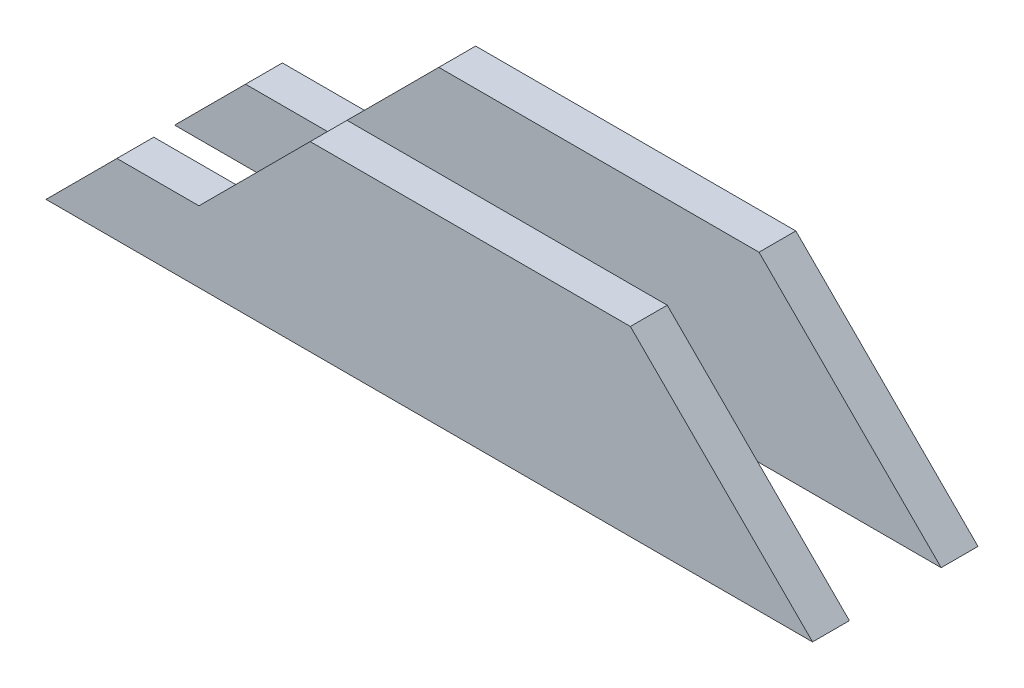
SolidWorks part; units mm, degrees
ref_plane "Front" through (0, 0, 0) normal (0, 0, 1) x (1, 0, 0)
ref_plane "Top" through (0, 0, 0) normal (0, 1, 0) x (1, 0, 0)
ref_plane "Right" through (0, 0, 0) normal (1, 0, 0) x (0, 0, -1)
sketch "Sketch1" plane through (0, 0, 0) normal (0, 1, 0) x (1, 0, 0)
  line L0 (24.765, 0) -> (0, 0) construction
  line L1 (-115.2652, 15.113) -> (24.765, 15.113)
  line L2 (-115.2652, 15.113) -> (-115.2652, -15.113)
  line L3 (-115.2652, -15.113) -> (24.765, -15.113)
  line L4 (24.765, 15.113) -> (24.765, -15.113)
  dimension "D1" = 30.226
  dimension "D2" = 140.0302
  dimension "D3" = 24.765
extrude "Extrude1" add sketch "Sketch1" along normal blind 12.954
sketch "Sketch2" plane through (0, 0, 0) normal (0, 0, 1) x (1, 0, 0)
  line L0 (11.811, 12.954) -> (-8.509, 33.274)
  line L1 (-8.509, 33.274) -> (-67.0052, 33.274)
  line L2 (-67.0052, 33.274) -> (-87.3252, 12.954)
  line L3 (-87.3252, 12.954) -> (11.811, 12.954)
  line L4 (-115.2652, 12.954) -> (24.765, 12.954) construction
  line L5 (11.811, 12.954) -> (24.765, 0) construction
  line L6 (-115.2652, 0) -> (24.765, 0) construction
  dimension "D1" = 45
  dimension "D2" = 27.94
  dimension "D3" = 33.274
  dimension "D4" = 45
extrude "Extrude2" add sketch "Sketch2" along normal up to surface and the other way up to surface
sketch "Sketch4" plane through (0, 0, 0) normal (1, 0, 0) x (0, 0, -1)
  line L0 (0, 0) -> (0, -8.4471) construction
  line L1 (8.382, -8.4471) -> (-8.382, -8.4471)
  line L2 (8.382, -8.4471) -> (8.382, 33.274)
  line L3 (8.382, 33.274) -> (-8.382, 33.274)
  line L4 (-8.382, -8.4471) -> (-8.382, 33.274)
  line L8 (-15.113, 33.274) -> (15.113, 33.274) construction
  dimension "D1" = 16.764
extrude "Extrude4" cut sketch "Sketch4" against normal through all and the other way through all
fillet "Fillet2" [suppressed] radius 2.3812
fillet "Fillet6" [suppressed] radius 2.3812
sketch "Sketch7" plane through (0, 0, 0) normal (0, 0, 1) x (1, 0, 0)
  line L0 (11.811, 12.954) -> (24.765, 0)
  line L1 (24.765, 0) -> (24.765, 12.954)
  line L2 (24.765, 12.954) -> (11.811, 12.954)
  line L3 (-102.3112, 12.954) -> (-115.2652, 12.954)
  line L4 (-115.2652, 12.954) -> (-115.2652, 0)
  line L5 (-115.2652, 0) -> (-102.3112, 12.954)
  line L6 (-115.2652, 0) -> (24.765, 0) construction
  line L7 (-115.2652, 12.954) -> (-115.2652, 0) construction
  line L8 (-115.2652, 12.954) -> (-87.3252, 12.954) construction
  line L9 (24.765, 12.954) -> (24.765, 0) construction
  line L10 (11.811, 12.954) -> (24.765, 12.954) construction
  dimension "D1" = 45
  dimension "D2" = 45
extrude "Extrude5" cut sketch "Sketch7" against normal through all and the other way through all
hole_wizard "#6-32 Tapped Hole2" positions "Sketch6" profile "Sketch5" tap size "#6-32" standard "Ansi Inch"
sketch "Sketch6" plane through (-15.8415, 4.1661, -15.113) normal (0, 0, 1) x (-1, 0, 0)
  line L2 (-40.6065, 4.1661) -> (99.4237, 4.1661) construction
  point P0 (80.3737, -2.1839)
  point P1 (-22.8138, 0.9911)
  dimension "D1" = 19.05
  dimension "D2" = 103.1875
  dimension "D3" = 6.35
  dimension "D4" = 3.175
sketch "Sketch5" plane through (-96.2152, 6.35, -15.113) normal (1, 0, 0) x (0, 1, 0)
  line L0 (0, 0) -> (0, 10.2107)
  line L1 (0, 10.2107) -> (1.3525, 9.398)
  line L2 (1.3525, 9.398) -> (1.3525, 0)
  line L5 (1.3525, 0) -> (0, 0)
  line L10 (0, 10.2107) -> (-1.3525, 9.398) construction
  line L11 (0, -6.35) -> (0, 107.95) construction
  dimension "Tap Drill Dia." = 2.7051
  dimension "Tap Drill Depth" = 9.398
  dimension "Drill Angle" = 118
hole_wizard "CSK for #6 Flat Head Machine Screw1" positions "Sketch9" profile "Sketch8" countersink size "#6" standard "Ansi Inch"
sketch "Sketch9" plane through (-36.8166, 6.8378, 15.113) normal (0, 0, -1) x (-1, 0, 0)
  line L0 (78.4486, -6.8378) -> (-61.5816, -6.8378) construction
  point P3 (59.3986, -0.4878)
  point P5 (-43.7889, -3.6628)
  dimension "D1" = 19.05
  dimension "D2" = 6.35
  dimension "D3" = 103.1875
  dimension "D4" = 3.175
sketch "Sketch8" plane through (-96.2152, 6.35, 15.113) normal (1, 0, 0) x (0, -1, 0)
  line L0 (0, 0) -> (0, 6.732)
  line L1 (0, 6.732) -> (1.8986, 6.732)
  line L2 (1.8986, 6.732) -> (1.8986, 1.892)
  line L3 (1.8986, 1.892) -> (3.5433, 0)
  line L5 (3.5433, 0) -> (0, 0)
  line L6 (-1.8986, 1.892) -> (-3.5433, 0) construction
  line L11 (0, -6.35) -> (0, 107.95) construction
  dimension "Thru Hole Dia." = 3.7973
  dimension "Thru Hole Depth" = 6.732
  dimension "Near C'Sink Dia." = 7.0866
  dimension "Near C'Sink Angle" = 82
hole_wizard "#6-32 Tapped Hole3" positions "Sketch11" profile "Sketch10" tap size "#6-32" standard "Ansi Inch"
sketch "Sketch11" plane through (0, 33.274, 0) normal (0, 1, 0) x (-1, 0, 0)
  line L0 (67.0052, -15.113) -> (8.509, -15.113) construction
  line L1 (67.0052, -10.7632) -> (67.0052, -15.113) construction
  point P0 (56.6864, -11.938)
  point P1 (18.5864, -11.938)
  dimension "D1" = 38.1
  dimension "D2" = 3.175
  dimension "D3" = 10.3187
sketch "Sketch10" plane through (-56.6864, 33.274, -11.938) normal (1, 0, 0) x (0, 0, 1)
  line L0 (0, 0) -> (0, 10.9981)
  line L1 (0, 10.9981) -> (1.3525, 10.1854)
  line L2 (1.3525, 10.1854) -> (1.3525, 0)
  line L5 (1.3525, 0) -> (0, 0)
  line L10 (0, 10.9981) -> (-1.3526, 10.1854) construction
  line L11 (0, -6.35) -> (0, 107.95) construction
  dimension "Tap Drill Dia." = 2.7051
  dimension "Tap Drill Depth" = 10.1854
  dimension "Drill Angle" = 118
hole_wizard "#6-32 Tapped Hole4" positions "Sketch13" profile "Sketch12" tap size "#6-32" standard "Ansi Inch"
sketch "Sketch13" plane through (0, 33.274, 0) normal (0, 1, 0) x (-1, 0, 0)
  line L0 (67.0052, 15.113) -> (8.509, 15.113) construction
  line L1 (67.0052, 15.113) -> (67.0052, 8.382) construction
  point P0 (56.6864, 11.938)
  point P1 (18.5864, 11.938)
  dimension "D1" = 3.175
  dimension "D2" = 38.1
  dimension "D3" = 10.3187
sketch "Sketch12" plane through (-56.6864, 33.274, 11.938) normal (1, 0, 0) x (0, 0, 1)
  line L0 (0, 0) -> (0, 10.9981)
  line L1 (0, 10.9981) -> (1.3525, 10.1854)
  line L2 (1.3525, 10.1854) -> (1.3525, 0)
  line L5 (1.3525, 0) -> (0, 0)
  line L10 (0, 10.9981) -> (-1.3525, 10.1854) construction
  line L11 (0, -6.35) -> (0, 107.95) construction
  dimension "Tap Drill Dia." = 2.7051
  dimension "Tap Drill Depth" = 10.1854
  dimension "Drill Angle" = 118
fillet "Fillet3" [suppressed] radius 13.4937
fillet "Fillet7" [suppressed] radius 13.4937
fillet "Fillet8" [suppressed] radius 2.3812
fillet "Fillet9" [suppressed] radius 2.3812
sketch "Sketch14" [suppressed] plane through (0, 0, 0) normal (0, 0, 1) x (1, 0, 0)
  line L0 (21.3974, 0) -> (-111.8976, 0) construction
  line L1 (-77.1652, 0) -> (1.5748, 0)
  line L2 (-77.1652, 0) -> (-77.1652, 4.572)
  line L3 (-73.9902, 7.747) -> (-1.6002, 7.747)
  line L4 (1.5748, 0) -> (1.5748, 4.572)
  arc A0 (-77.1652, 4.572) -> (-73.9902, 7.747) centre (-73.9902, 4.572) cw
  arc A1 (-1.6002, 7.747) -> (1.5748, 4.572) centre (-1.6002, 4.572) cw
  dimension "D4" = 3.175
  dimension "D1" = 38.1
  dimension "D2" = 78.74
  dimension "D3" = 7.747
extrude "Extrude7" [suppressed] cut sketch "Sketch14" against normal through all and the other way through all
sketch "Sketch3" [suppressed] plane through (0, 0, 0) normal (0, 0, 1) x (1, 0, 0)
  line L0 (-67.0052, 33.2994) -> (-67.0052, 33.3756)
  line L1 (-67.0052, 33.274) -> (-8.509, 33.274) construction
  line L2 (-60.6552, 39.7256) -> (-44.7802, 39.7256)
  line L3 (-44.7802, 39.7256) -> (-8.8392, 34.2071)
  line L4 (-67.0052, 33.2994) -> (-8.8392, 33.2994)
  line L8 (-8.8392, 34.2071) -> (-8.8392, 33.2994)
  arc A0 (-60.6552, 39.7256) -> (-67.0052, 33.3756) centre (-60.6552, 33.3756) ccw
  dimension "D4" = 6.35
  dimension "D1" = 15.875
  dimension "D2" = 58.166
  dimension "D3" = 6.4262
  dimension "D5" = 0.0254
extrude "Extrude6" [suppressed] add sketch "Sketch3" along normal up to surface and the other way up to surface
hole_wizard "CSK for #6 Flat Head Machine Screw3" positions "Sketch16" profile "Sketch15" countersink size "#6" standard "ANSI Inch"
sketch "Sketch16" [suppressed] plane through (0, 39.7256, 0) normal (0, 1, 0) x (1, 0, 0)
  point P0 (647.1534, -148.7442)
  point P1 (-56.6864, -11.938)
  point P4 (-18.5864, -11.938)
  point P7 (-18.5864, 11.938)
  point P10 (-56.6864, 11.938)
sketch "Sketch15" plane through (647.1534, 39.7256, 148.7442) normal (1, 0, 0) x (0, 0, 1)
  line L0 (0, 0) -> (0, 7.487)
  line L1 (0, 7.487) -> (1.8288, 6.3881)
  line L2 (1.8288, 6.3881) -> (1.8288, 1.9723)
  line L3 (1.8288, 1.9723) -> (3.5433, 0)
  line L5 (3.5433, 0) -> (0, 0)
  line L6 (-1.8288, 1.9723) -> (-3.5433, 0) construction
  line L10 (0, 7.487) -> (-1.8288, 6.3881) construction
  line L11 (0, -6.35) -> (0, 107.95) construction
  dimension "Hole Dia." = 3.6576
  dimension "Hole Depth" = 39.7256
  dimension "Near C'Sink Dia." = 7.0866
  dimension "Near C'Sink Angle" = 82
  dimension "Drill Angle" = 118
